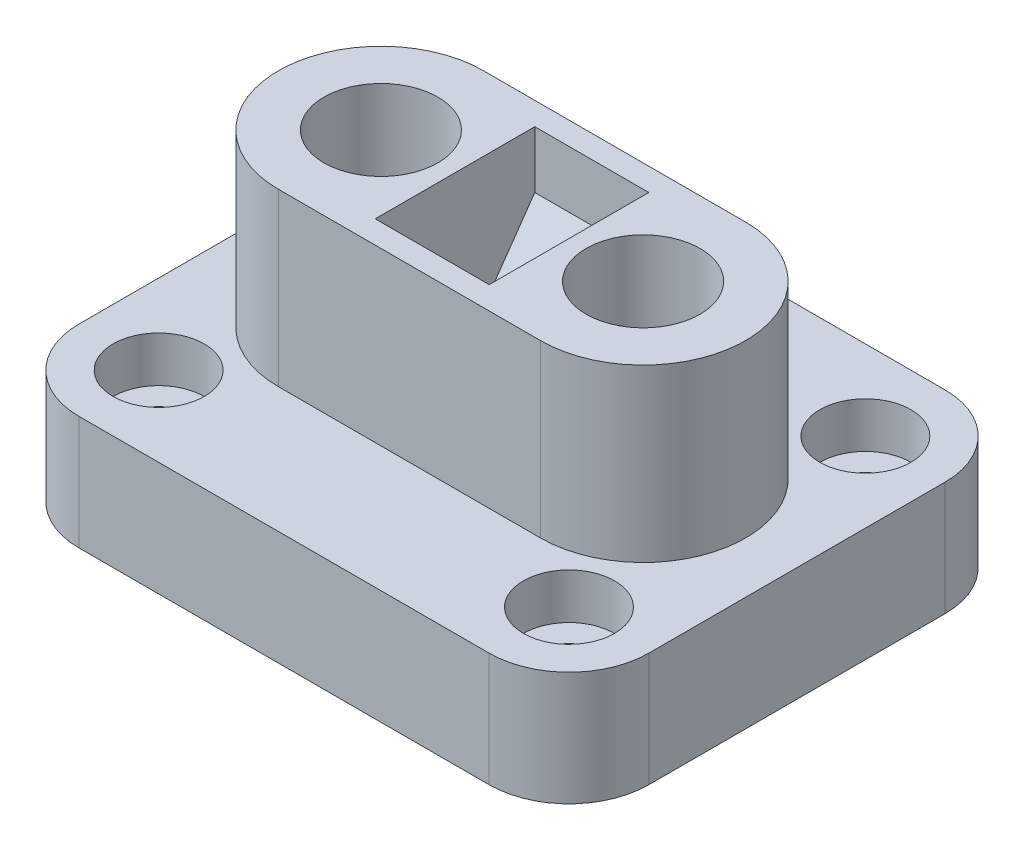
SolidWorks part; units mm, degrees
ref_plane "Front Plane" through (0, 0, 0) normal (0, 0, 1) x (1, 0, 0)
ref_plane "Top Plane" through (0, 0, 0) normal (0, 1, 0) x (1, 0, 0)
ref_plane "Right Plane" through (0, 0, 0) normal (1, 0, 0) x (0, 0, -1)
sketch "Sketch1" plane through (0, 0, 0) normal (0, 1, 0) x (1, 0, 0)
  line L1 (-50, 40) -> (50, 40)
  line L2 (-50, 40) -> (-50, -40)
  line L3 (-50, -40) -> (50, -40)
  line L4 (50, 40) -> (50, -40)
  dimension "D1" = 50
  dimension "D2" = 100
  dimension "D3" = 40
  dimension "D4" = 80
extrude "Extrude1" add sketch "Sketch1" along normal blind 20
sketch "Sketch2" plane through (0, 20, 0) normal (0, 1, 0) x (-1, 0, 0)
  line L0 (-23, -18) -> (23, -18)
  line L1 (23, 18) -> (-23, 18)
  line L2 (0, 11) -> (0, -11) construction
  line L3 (11, 0) -> (-11, 0) construction
  arc A0 (23, -18) -> (23, 18) centre (23, 0) ccw
  arc A1 (-23, 18) -> (-23, -18) centre (-23, 0) ccw
  dimension "D2" = 46
  dimension "D1" = 23
  dimension "D3" = 18
  dimension "D4" = 36
extrude "Extrude2" add sketch "Sketch2" along normal blind 30
other "Hole1"
sketch "Sketch3" plane through (0, 50, 0) normal (0, 1, 0) x (-1, 0, 0)
  circle A0 centre (23, 0) radius 10
  arc A1 (23, -18) -> (23, 18) centre (23, 0) ccw construction
  dimension "D1" = 20
pattern_linear "LPattern1" count 2 spacing 46 along (1, 0, 0) of "Hole1"
hole_wizard "CBORE for M5 Hex Head Bolt1" positions "Sketch5" profile "Sketch4" counterbore size "M5" standard "Ansi Metric"
sketch "Sketch5" plane through (0, 20, 0) normal (0, 1, 0) x (-1, 0, 0)
  point P0 (36, 26)
  dimension "D1" = 14
  dimension "D2" = 14
sketch "Sketch4" plane through (-36, 20, 26) normal (1, 0, 0) x (0, 0, 1)
  line L0 (0, 0) -> (0, 20)
  line L1 (0, 20) -> (3.5, 20)
  line L3 (3.5, 20) -> (3.5, 8)
  line L4 (3.5, 8) -> (8, 8)
  line L5 (8, 8) -> (8, 0)
  line L7 (8, 0) -> (0, 0)
  line L11 (0, -6.35) -> (0, 107.95) construction
  dimension "Thru Hole Dia." = 7
  dimension "Thru Hole Depth" = 20
  dimension "C'Bore Dia." = 16
  dimension "C'Bore Depth" = 8
pattern_linear "LPattern2" count 2 spacing 72 along (1, 0, 0) count 2 spacing 52 along (0, 0, -1) of "CBORE for M5 Hex Head Bolt1"
fillet "Fillet1" radius 14 4 edges at (-50, 10, -40) (50, 10, -40) (50, 10, 40) (-50, 10, 40)
sketch "Sketch7" plane through (0, 0, 0) normal (1, 0, 0) x (0, 0, -1)
  line L0 (-8, 0) -> (-8, 30)
  line L1 (-8, 30) -> (-14, 30)
  line L2 (-14, 30) -> (-14, 50)
  line L3 (-14, 50) -> (14, 50)
  line L4 (14, 50) -> (14, 40)
  line L5 (14, 40) -> (0, 20)
  line L6 (0, 20) -> (0, 0)
  line L7 (0, 0) -> (-8, 0)
  line L8 (18, 50) -> (-18, 50) construction
  dimension "D1" = 8
  dimension "D2" = 6
  dimension "D3" = 30
  dimension "D4" = 20
  dimension "D5" = 14
  dimension "D6" = 10
extrude "Cut-Extrude1" cut sketch "Sketch7" against normal mid plane 20
